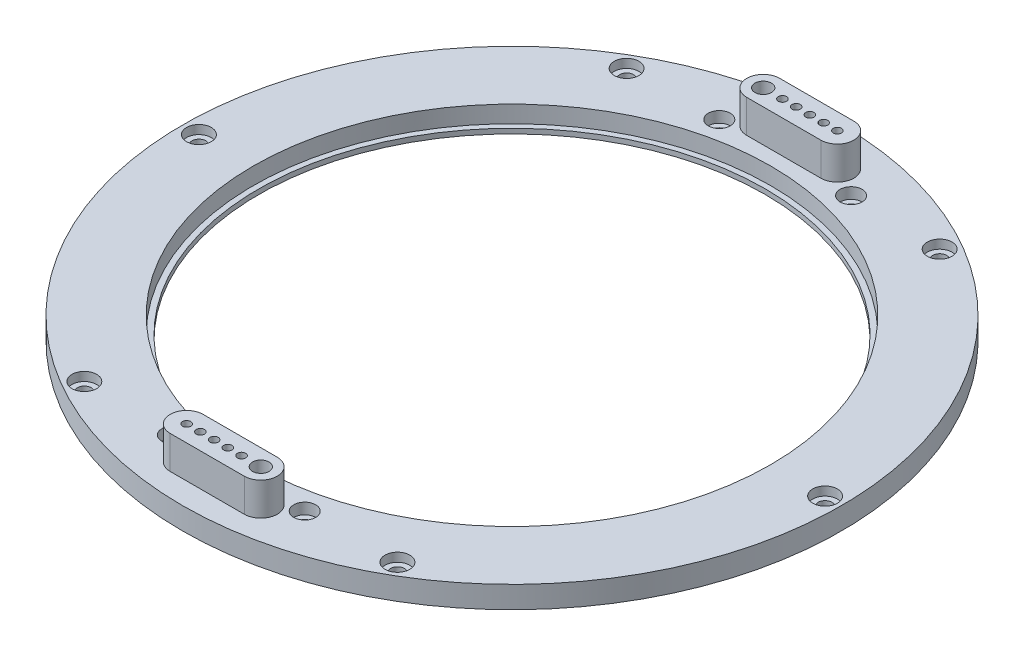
SolidWorks part; units mm, degrees
ref_plane "前视基准面" through (0, 0, 0) normal (0, 0, 1) x (1, 0, 0)
ref_plane "上视基准面" through (0, 0, 0) normal (0, 1, 0) x (1, 0, 0)
ref_plane "右视基准面" through (0, 0, 0) normal (1, 0, 0) x (0, 0, -1)
sketch "草图1" plane through (0, 0, 0) normal (0, 1, 0) x (1, 0, 0)
  circle A0 centre (0, 0) radius 47.1
  circle A1 centre (0, 0) radius 60
  dimension "D1" = 94.2
  dimension "D2" = 120
extrude "凸台-拉伸1" add sketch "草图1" along normal blind 4
sketch "草图2" plane through (0, 0, 0) normal (0, -1, 0) x (1, 0, 0)
  circle A0 centre (0, 0) radius 46.1
  circle A2 centre (0, 0) radius 47.1 construction
  circle A3 centre (0, 0) radius 47.1
  dimension "D1" = 1
extrude "凸台-拉伸2" add sketch "草图2" against normal blind 0.9
sketch "草图3" plane through (0, 4, 0) normal (0, 1, 0) x (1, 0, 0)
  circle A0 centre (7, -52.7359) radius 1.5
  circle A1 centre (3.5, -52.7359) radius 0.75
  circle A2 centre (1, -52.7359) radius 0.75
  circle A3 centre (-1.5, -52.7359) radius 0.75
  circle A4 centre (-4, -52.7359) radius 0.75
  circle A5 centre (-6.5, -52.7359) radius 0.75
  circle A6 centre (6.5, 52.7359) radius 0.75
  circle A7 centre (4, 52.7359) radius 0.75
  circle A8 centre (1.5, 52.7359) radius 0.75
  circle A9 centre (-1, 52.7359) radius 0.75
  circle A10 centre (-3.5, 52.7359) radius 0.75
  circle A11 centre (-7, 52.7359) radius 1.5
  dimension "D1" = 3
extrude "切除-拉伸1" cut sketch "草图3" against normal through all
sketch "草图4" plane through (0, 0, 0) normal (0, -1, 0) x (1, 0, 0)
  circle A0 centre (-12, -49.7359) radius 1
  circle A1 centre (12, -49.7359) radius 1
  circle A2 centre (-12, 49.7359) radius 1
  circle A3 centre (12, 49.7359) radius 1
  dimension "D1" = 2
extrude "切除-拉伸2" cut sketch "草图4" against normal through all
sketch "草图6" plane through (0, 4, 0) normal (0, -1, 0) x (1, 0, 0)
  circle A0 centre (-12, -49.7359) radius 2
  circle A1 centre (12, -49.7359) radius 2
  circle A2 centre (-12, 49.7359) radius 2
  circle A3 centre (12, 49.7359) radius 2
extrude "切除-拉伸3" cut sketch "草图6" along normal blind 2
sketch "草图7" plane through (0, 4, 0) normal (0, 1, 0) x (1, 0, 0)
  circle A0 centre (0, 0) radius 57 construction
  circle A1 centre (0, 0) radius 60 construction
  circle A2 centre (-57, 0) radius 1.25
  circle A3 centre (-28.5, 49.3634) radius 1.25
  circle A4 centre (28.5, 49.3634) radius 1.25
  circle A5 centre (57, 0) radius 1.25
  circle A6 centre (28.5, -49.3634) radius 1.25
  circle A7 centre (-28.5, -49.3634) radius 1.25
  point P19 (0, 0)
  dimension "D1" = 3
  dimension "D2" = 6
extrude "切除-拉伸4" cut sketch "草图7" against normal through all
sketch "草图8" plane through (0, 4, 0) normal (0, 1, 0) x (1, 0, 0)
  circle A0 centre (-28.5, 49.3634) radius 2.25
  circle A1 centre (-57, 0) radius 2.25
  circle A2 centre (-28.5, -49.3634) radius 2.25
  circle A3 centre (28.5, -49.3634) radius 2.25
  circle A4 centre (57, 0) radius 2.25
  circle A5 centre (28.5, 49.3634) radius 2.25
extrude "切除-拉伸5" cut sketch "草图8" against normal blind 1.6
sketch "草图9" plane through (0, 4, 0) normal (0, 1, 0) x (1, 0, 0)
  line L0 (-7, 52.7359) -> (6.5, 52.7359) construction
  line L1 (-7, 55.7359) -> (6.5, 55.7359)
  line L2 (-7, 49.7359) -> (6.5, 49.7359)
  arc A0 (-7, 55.7359) -> (-7, 49.7359) centre (-7, 52.7359) ccw
  circle A1 centre (-7, 52.7359) radius 1.5 construction
  arc A2 (6.5, 49.7359) -> (6.5, 55.7359) centre (6.5, 52.7359) ccw
  circle A3 centre (6.5, 52.7359) radius 0.75 construction
  circle A4 centre (4, 52.7359) radius 0.75 construction
  circle A5 centre (1.5, 52.7359) radius 0.75 construction
  circle A6 centre (-1, 52.7359) radius 0.75 construction
  circle A7 centre (-3.5, 52.7359) radius 0.75 construction
  circle A8 centre (6.5, 52.7359) radius 0.75
  circle A9 centre (4, 52.7359) radius 0.75
  circle A10 centre (1.5, 52.7359) radius 0.75
  circle A11 centre (-1, 52.7359) radius 0.75
  circle A12 centre (-3.5, 52.7359) radius 0.75
  circle A13 centre (-7, 52.7359) radius 1.5
  dimension "D1" = 1.5
  dimension "D2" = 6
extrude "凸台-拉伸3" add sketch "草图9" along normal blind 6
pattern_circular "阵列(圆周)1" count 2 over 360 about axis through (0, 0, 0) along (0, 1, 0) of "凸台-拉伸3"
